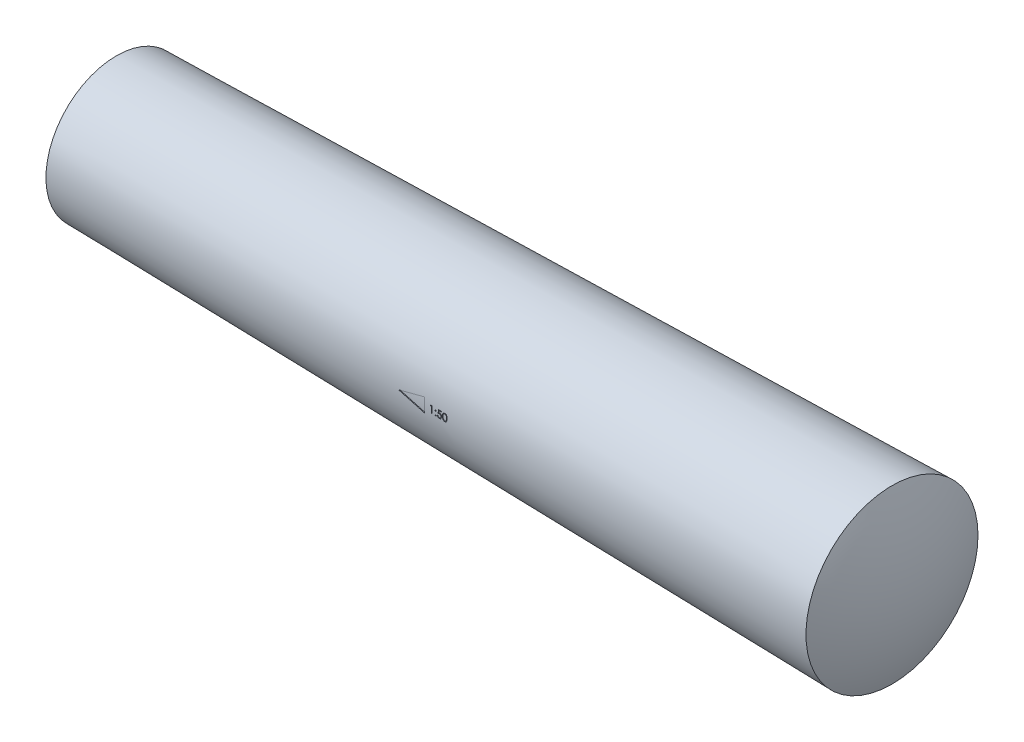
SolidWorks part; units mm, degrees
ref_plane "Front Plane" through (0, 0, 0) normal (0, 0, 1) x (1, 0, 0)
ref_plane "Top Plane" through (0, 0, 0) normal (0, 1, 0) x (1, 0, 0)
ref_plane "Right Plane" through (0, 0, 0) normal (1, 0, 0) x (0, 0, -1)
sketch "Sketch1" plane through (0, 0, 0) normal (1, 0, 0) x (0, 0, -1)
  circle A0 centre (0, 0) radius 10
  dimension "D1" = 20
extrude "Extrude1" add sketch "Sketch1" along normal mid plane 110
draft "Draft1" type of draft neutral plane draft angle 1.146 faces to draft 1 parameters "D1"=1.146
sketch "Sketch2" plane through (0, 0, 0) normal (0, 0, 1) x (1, 0, 0)
  line L0 (-55, 0) -> (-55, 10)
  line L1 (-55, 10) -> (-55, -10) construction
  line L2 (-55, 0) -> (-57.5, 0)
  line L3 (-57.5, 0) -> (-57.5, -11.1) construction
  line L4 (55, 0) -> (55, 12.2001)
  line L5 (55, -12.2001) -> (55, 12.2001) construction
  line L6 (55, 0) -> (57.5, 0)
  line L7 (57.5, 0) -> (57.5, -11.1) construction
  line L8 (-55, -10) -> (55, -12.2001) construction
  arc A0 (-57.5, 0) -> (-55, 10) centre (-36.25, 0) cw
  arc A1 (57.5, 0) -> (55, 12.2001) centre (26.4817, 0) ccw
  point P14 (0, -11.1)
revolve "Revolve1" add sketch "Sketch2" angle 360 about L2
sketch "Sketch5" plane through (0, 0, 0) normal (0, 0, 1) x (1, 0, 0)
  line L0 (0, 11.1) -> (0, -11.1) construction
  line L1 (55, 12.2001) -> (-55, 10) construction
  line L2 (-55, -10) -> (55, -12.2001) construction
ref_plane "Plane2" through (0, 0, 0) normal (-0.02, 0, 0.9998) x (0.9998, 0, 0.02)
sketch "Sketch6" plane through (0, 0, 0) normal (-0.02, 0, 0.9998) x (0.9998, 0, 0.02)
  line L0 (0, 0) -> (0, 1)
  line L1 (0, 11.1) -> (0, -11.1) construction
  line L2 (0, 1) -> (-3.7321, 0)
  line L3 (-3.7321, 0) -> (0, -1)
  line L4 (0, -1) -> (0, 0)
  line L5 (0, -0.5) -> (4, -0.5) construction
  text T0 "1:50" font "Century Gothic" height 1
  dimension "D1" = 2
  dimension "D2" = 30
  dimension "D3" = 4
wrap "Wrap2" sketch "Sketch6" wrap type deboss source sketch "Sketch6" thickness 0.1 parameters "D1"=0.1
equation "\"D2@Sketch2\" = \"D1@Sketch2\""
